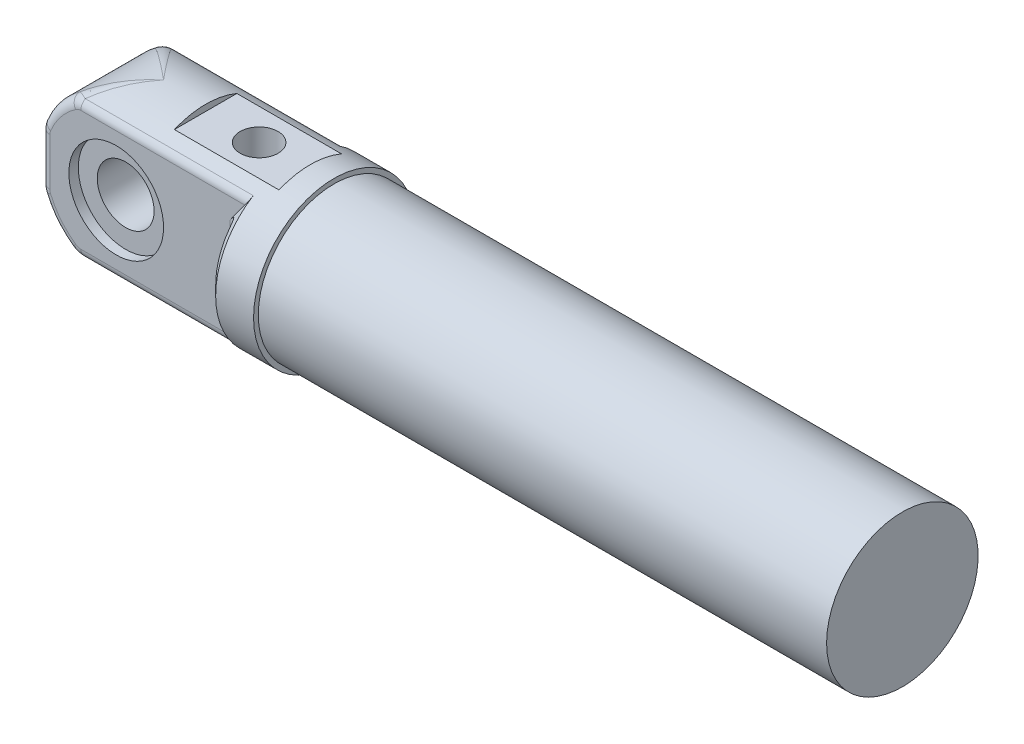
SolidWorks part; units mm, degrees
ref_plane "Face" through (0, 0, 0) normal (0, 0, 1) x (1, 0, 0)
ref_plane "Dessus" through (0, 0, 0) normal (0, 1, 0) x (1, 0, 0)
ref_plane "Droite" through (0, 0, 0) normal (1, 0, 0) x (0, 0, -1)
sketch "Esquisse1" plane through (0, 0, 0) normal (0, 0, 1) x (1, 0, 0)
  line L0 (0, 0) -> (156, 0) construction
  line L1 (0, 0) -> (0, 17)
  line L2 (0, 17) -> (36, 17)
  line L3 (36, 17) -> (36, 16)
  line L4 (36, 16) -> (156, 16)
  line L5 (156, 16) -> (156, 0)
  line L6 (0, 0) -> (156, 0)
  dimension "D1" = 32
  dimension "D2" = 34
  dimension "D3" = 36
  dimension "D4" = 120
revolve "Révolution1" add sketch "Esquisse1" angle 360 about L0
sketch "Esquisse3" plane through (0, 0, 0) normal (-1, 0, 0) x (0, 0, 1)
  circle A1 centre (0, 0) radius 17
  circle A2 centre (0, 0) radius 17
  dimension "D1" = 0
extrude "Extrusion1" add sketch "Esquisse3" along normal blind 16
sketch "Esquisse2" plane through (0, 0, 0) normal (0, 1, 0) x (1, 0, 0)
  line L0 (-16, 10) -> (26, 10)
  line L2 (26, 10) -> (26, 24.0741)
  line L3 (26, 24.0741) -> (-16, 24.0741)
  line L4 (-16, 24.0741) -> (-16, 10)
  line L5 (0, 0) -> (23.1852, 0) construction
  line L6 (-16, -24.0741) -> (-16, -10)
  line L7 (26, -24.0741) -> (-16, -24.0741)
  line L8 (26, -10) -> (26, -24.0741)
  line L9 (-16, -10) -> (26, -10)
  line L10 (-16, 17) -> (-16, -17) construction
  dimension "D1" = 26
  dimension "D2" = 20
extrude "Enlèv. mat.-Extru.1" cut sketch "Esquisse2" against normal mid plane 50
sketch "Esquisse4" plane through (0, 0, 10) normal (0, 0, 1) x (1, 0, 0)
  line L0 (0, 17) -> (-16, 17)
  line L1 (-16, 17) -> (-16, 5.7446)
  line L2 (-16, -17) -> (0, -17)
  line L3 (-16, -5.7446) -> (-16, -17)
  arc A0 (0, 17) -> (-16, 5.7446) centre (0, 0) ccw
  arc A1 (-16, -5.7446) -> (0, -17) centre (0, 0) ccw
  circle A2 centre (0, 0) radius 6
  dimension "D1" = 12
extrude "Enlèv. mat.-Extru.2" cut sketch "Esquisse4" against normal through all
sketch "Esquisse5" plane through (0, 0, 10) normal (0, 0, 1) x (1, 0, 0)
  circle A0 centre (0, 0) radius 10
  dimension "D1" = 20
extrude "Enlèv. mat.-Extru.3" cut sketch "Esquisse5" against normal blind 2
sketch "Esquisse6" plane through (0, 0, -10) normal (0, 0, -1) x (-1, 0, 0)
  circle A0 centre (0, 0) radius 10
  dimension "D1" = 20
extrude "Enlèv. mat.-Extru.4" cut sketch "Esquisse6" against normal blind 2
chamfer "Chanfrein1" distance 2 angle 45 2 edges at (26, 0, -17) (26, 0, 17)
fillet "Congé4" radius 2 2 edges at (26, 0, 10) (26, 0, -10)
fillet "Congé1" radius 4 2 edges at (-16, 5.7446, 0) (-16, -5.7446, 0)
fillet "Congé2" radius 3 4 edges at (-5.2578, 16.1665, -5.2578) (-5.2578, 16.1665, 5.2578) (-5.2578, -16.1665, 5.2578) (-5.2578, -16.1665, -5.2578)
fillet "Congé3" radius 2 24 edges at (26, -11.1803, 10) (26, 11.1803, -10) (-16, 0, 10) (-16, 0, -10) (-14.1732, 9.3873, 10) (-14.1732, -9.3873, 10) (-15.9223, 5.7845, 10) (-15.9223, -5.7845, 10) (-14.1732, 9.3873, -10) (-15.9223, 5.7845, -10) (-15.9223, -5.7845, -10) (9.8824, -13.7477, -10) (9.8824, 13.7477, 10) (-4.3299, 16.1665, -5.2578) (-4.3299, -16.1665, 5.2578) (-14.1732, -9.3873, -10) (-10.2678, 13.2535, -10) (-9.7353, -13.4742, -10) (-6.5857, -15.6726, -5.4235) (-9.7353, 13.4742, 10) (-10.2678, -13.2535, 10) (-6.5857, 15.6726, 5.4235) (9.8824, 13.7477, -10) (9.8824, -13.7477, 10)
sketch "Esquisse7" plane through (0, 0, 0) normal (0, 0, 1) x (1, 0, 0)
  line L1 (30.9697, 20.4361) -> (8.8837, 20.4361)
  line L2 (30.9697, 20.4361) -> (30.9697, 15.6676)
  line L3 (30.9697, 15.6676) -> (8.8837, 15.6676)
  line L4 (8.8837, 20.4361) -> (8.8837, 15.6676)
extrude "Enlèv. mat.-Extru.5" cut sketch "Esquisse7" against normal mid plane 40
sketch "Esquisse8" plane through (0, 15.6676, 0) normal (0, 1, 0) x (-1, 0, 0)
  circle A0 centre (-20.1804, 0) radius 4
  dimension "D1" = 8
extrude "Enlèv. mat.-Extru.6" cut sketch "Esquisse8" against normal blind 10
